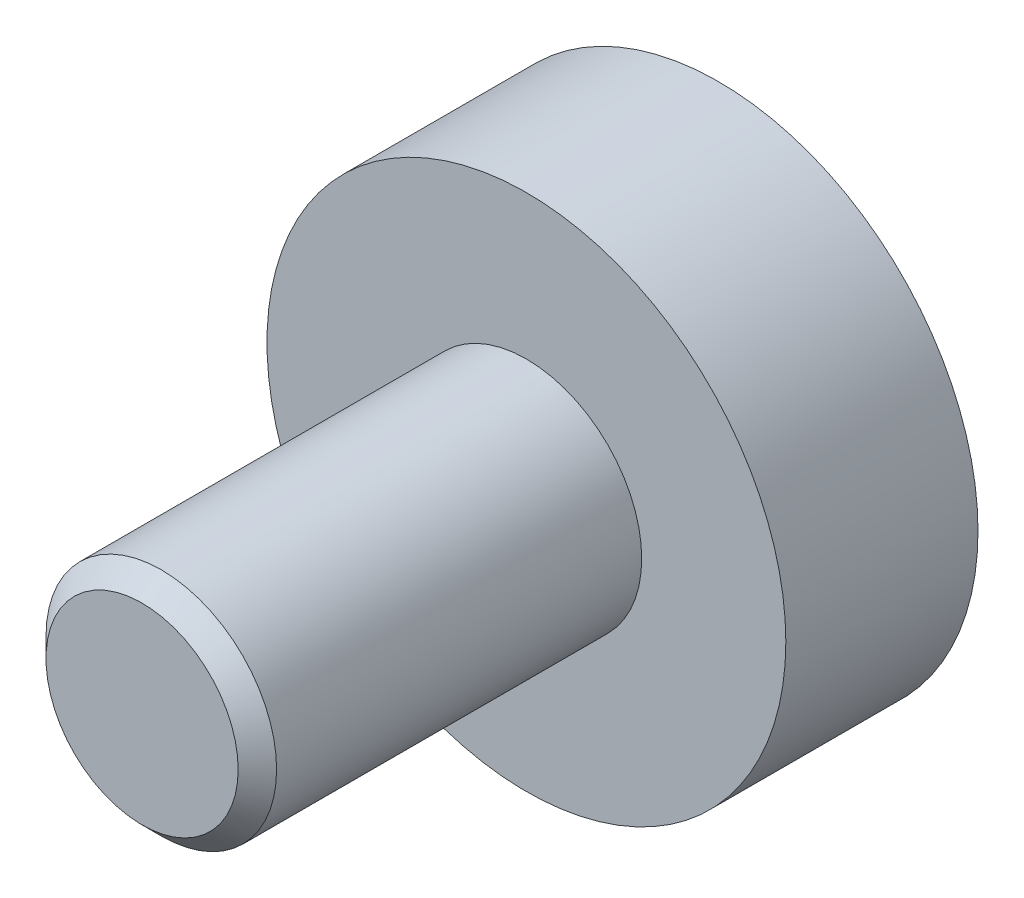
SolidWorks part; units mm, degrees
ref_plane "Plan de face" through (0, 0, 0) normal (0, 0, 1) x (1, 0, 0)
ref_plane "Plan de dessus" through (0, 0, 0) normal (0, 1, 0) x (1, 0, 0)
ref_plane "Plan de droite" through (0, 0, 0) normal (1, 0, 0) x (0, 0, -1)
sketch "Esquisse1" plane through (0, 0, 0) normal (0, 0, 1) x (1, 0, 0)
  circle A0 centre (0, 0) radius 13.5
  dimension "D1" = 27
extrude "Extrusion1" add sketch "Esquisse1" along normal blind 10
sketch "Esquisse2" plane through (0, 0, 10) normal (0, 0, 1) x (1, 0, 0)
  circle A0 centre (0, 0) radius 6
  dimension "D1" = 12
extrude "Extrusion2" add sketch "Esquisse2" along normal blind 20
chamfer "Chanfrein1" distance 1 angle 45 1 edges at (6, 0, 30)
sketch "Esquisse3" plane through (0, 0, 0) normal (0, 1, 0) x (1, 0, 0)
  line L0 (0, 57.9845) -> (0, -33.387) construction
  line L1 (0, -3.2091) -> (0, 56.7909)
  arc A0 (0, 56.7909) -> (0, -3.2091) centre (0, 26.7909) ccw
  dimension "D1" = 60
revolve "Enlèvement de matière-Révolution1" cut sketch "Esquisse3" angle 360 about L0
